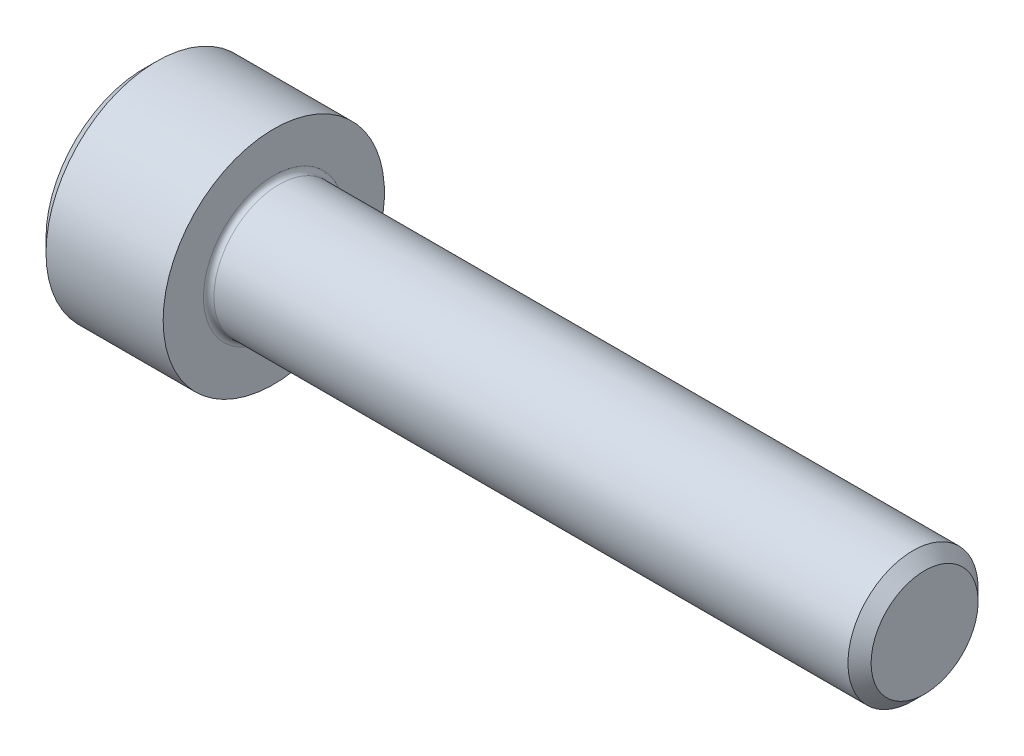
SolidWorks part; units mm, degrees
ref_plane "Plane1" through (0, 0, 0) normal (0, 0, 1) x (1, 0, 0)
ref_plane "Plane2" through (0, 0, 0) normal (0, 1, 0) x (1, 0, 0)
ref_plane "Plane3" through (0, 0, 0) normal (1, 0, 0) x (0, 0, -1)
revolve "Base-Revolve" add sketch "BodySke"
sketch "BodySke" plane through (0, 0, 0) normal (0, 0, 1) x (1, 0, 0)
  line L0 (0, 0) -> (0, 3.75)
  line L1 (0.5, 4.25) -> (5, 4.25)
  line L2 (5, 4.25) -> (5, 2.5)
  line L3 (5, 2.5) -> (29.555, 2.5)
  line L4 (30, 2.055) -> (30, 0)
  line L5 (30, 0) -> (0, 0)
  line L6 (-31.75, 0) -> (127, 0) construction
  line L7 (0, 3.75) -> (0.5, 4.25)
  line L8 (30, 2.055) -> (29.555, 2.5)
  line L9 (0, -3.75) -> (0.5, -4.25) construction
  line L10 (30, -2.055) -> (29.555, -2.5) construction
  line L11 (5.8, 9.525) -> (5.8, 3.175) construction
  line L12 (5, 9.525) -> (5, 3.175) construction
  line L13 (-20, 9.525) -> (-20, 3.175) construction
  dimension "Diameter" = 5
  dimension "Head_ht" = 5
  dimension "Length" = 25
  dimension "Body_ch_ang" = 45
  dimension "Head_dia" = 8.5
  dimension "Head_ch_ang" = 45
  dimension "Minor_dia" = 4.11
  dimension "Advance" = 0.8
  dimension "Thread_nom" = 25
  dimension "Thread_length" = 50
  dimension "Head_ch_ht" = 0.5
fillet "Fillet1" radius 0.2 1 edges at (5, 0, 2.5)
sketch "Sketch2" plane through (0, 0, 0) normal (0, 0, 1) x (1, 0, 0)
  line L0 (0, 2.042) -> (2.5, 2.042)
  line L1 (2.5, 2.042) -> (3.6789, 0)
  line L2 (-31.75, 0) -> (127, 0) construction
  line L3 (3.6789, 0) -> (0, 0)
  line L4 (0, 0) -> (0, 2.042)
  line L5 (0, 3.75) -> (0, -3.75) construction
  line L6 (0, 0) -> (47.625, 0) construction
  line L7 (5, -4.25) -> (5, 4.25) construction
  dimension "D1" = 2.042
  dimension "D2" = 60
  dimension "Wall_thickness" = 2.5
revolve "Hex-PreBroach" cut sketch "Sketch2" angle 360 about L6
sketch "Sketch3" plane through (0, 0, 0) normal (-1, 0, 0) x (0, 0.5, 0.866)
  line L0 (1.1789, 2.042) -> (-1.1789, 2.042)
  line L1 (-1.1789, 2.042) -> (-2.3579, 0)
  line L2 (1.1789, 2.042) -> (2.3579, 0)
  line L3 (1.1789, -2.042) -> (2.3579, 0)
  line L4 (1.1789, -2.042) -> (-1.1789, -2.042)
  line L5 (-1.1789, -2.042) -> (-2.3579, 0)
  dimension "D1" = 2.042
  dimension "D2" = 2.042
  dimension "Hex_size" = 4.084
extrude "Hex" cut sketch "Sketch3" against normal blind 2.5
sketch "Sketch4" plane through (0, 0, 0) normal (-1, 0, 0) x (0, 0, 1)
  line L0 (0, 0) -> (2.3876, 0)
  line L1 (0, 0) -> (6.1484, 3.5498) construction
  line L2 (0, 0) -> (1.1938, 2.0677)
  line L3 (1.9883, 0.576) -> (2.2704, 0.7389)
  line L4 (1.493, 1.4339) -> (1.7751, 1.5968)
  arc A0 (1.9883, 0.576) -> (1.493, 1.4339) centre (0, 0) ccw
  arc A1 (2.3876, 0) -> (2.2704, 0.7389) centre (0, 0) ccw
  arc A2 (1.1938, 2.0677) -> (1.7751, 1.5968) centre (0, 0) cw
  dimension "D1" = 30
  dimension "Spline_n_dim" = 4.1402
  dimension "Spline_m_dim" = 4.7752
  dimension "D2" = 60
  dimension "D3" = 0.4953
  dimension "Spline_p_dim" = 0.9906
extrude "Spline" cut sketch "Sketch4" against normal blind 2.5
pattern_circular "CirPattern1" count 6 every 60
sketch "Sketch5" plane through (0, 0, 0) normal (0, 0, 1) x (1, 0, 0)
  line L0 (-31.75, 0) -> (127, 0) construction
  line L2 (0, 3.75) -> (0, -3.75) construction
  circle A0 centre (2, 0) radius 0.675
  dimension "Drilled_hole_dia" = 1.35
  dimension "Drilled_hole_loc" = 2
extrude "Hole" cut sketch "Sketch5" against normal through all and the other way through all
pattern_circular "Drilled-4" count 2 every 60
pattern_circular "Drilled-6" count 3 every 60
sketch "ThdSchSke" plane through (0, 0, 0) normal (0, 0, 1) x (1, 0, 0)
  line L0 (5.8, -2.055) -> (5.4884, -2.5)
  line L1 (5.8, -2.055) -> (6.1116, -2.5)
  line L2 (6.1116, -2.5) -> (6.1116, -3.125)
  line L3 (-3.175, 0) -> (5.1513, 0) construction
  line L5 (6.1116, -3.125) -> (5.4884, -3.125)
  line L6 (5.4884, -3.125) -> (5.4884, -2.5)
  line L7 (0, 3.75) -> (0, -3.75) construction
  dimension "Thread_minor" = 4.11
  dimension "Diameter" = 5
  dimension "Start" = 5.8
  dimension "SideAngle" = 55
  dimension "VeeAngle" = 70
  dimension "Overcut" = 6.25
revolve "ThreadSchematic" cut sketch "ThdSchSke" angle 360 about L3
pattern_linear "ThdSchPat"
equation "\"D2@Sketch3\" = \"Hex_size@Sketch3\" / 2"
equation "\"D1@Sketch3\" = \"Hex_size@Sketch3\" / 2"
equation "\"D1@Sketch2\" = \"Hex_size@Sketch3\" / 2"
equation "\"D3@Sketch4\" = \"Spline_p_dim@Sketch4\" / 2"
equation "\"Thread_minor@ThreadCosmetic\"  =  \"Minor_dia@BodySke\""
equation "\"D2@CirPattern1\" = 360 / \"Num_teeth@CirPattern1\""
equation "\"Wall_thickness@Sketch2\" = \"Head_ht@BodySke\" - \"Key_eng@Hex\""
equation "\"Thread_length@ThreadCosmetic\" = ((sgn( (\"Length@BodySke\" - \"Advance@BodySke\" ) - \"Thread_nom@BodySke\" )-1)*( (\"Length@BodySke\" - \"Advance@BodySke\" ) - \"Thread_nom@BodySke\" ))/-2+ \"Thread_nom@BodySke\""
equation "\"Thread_minor@ThdSchSke\" = \"Minor_dia@BodySke\""
equation "\"Diameter@ThdSchSke\" = \"Diameter@BodySke\""
equation "\"Overcut@ThdSchSke\" = \"Diameter@BodySke\" * 1.25"
equation "\"Start@ThdSchSke\" = \"Head_ht@BodySke\" + \"Length@BodySke\" - \"Thread_length@ThreadCosmetic\"  '---Non-countersunk---"
equation "\"Num_threads@ThdSchPat\" = int( \"Thread_length@ThreadCosmetic\" / \"Advance@BodySke\" + 0.999 )  + 1"
equation "\"Advance@ThdSchPat\" = \"Thread_length@ThreadCosmetic\" /  (\"Num_threads@ThdSchPat\" - 1) 'relax it"
equation "\"Num_threads@ThdSchPat\" = \"Num_threads@ThdSchPat\" - sgn( \"Num_threads@ThdSchPat\" - 1) '---chamfered tips only---"
